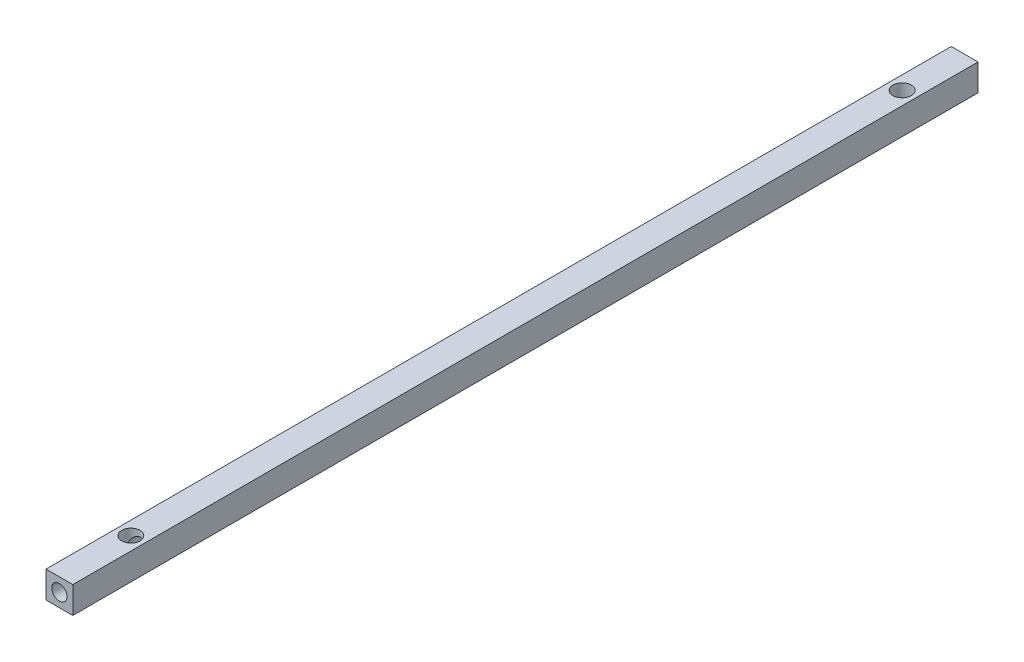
SolidWorks part; units mm, degrees
ref_plane "Front Plane" through (0, 0, 0) normal (0, 0, 1) x (1, 0, 0)
ref_plane "Top Plane" through (0, 0, 0) normal (0, 1, 0) x (1, 0, 0)
ref_plane "Right Plane" through (0, 0, 0) normal (1, 0, 0) x (0, 0, -1)
sketch "Sketch1" plane through (0, 0, 0) normal (0, 0, 1) x (1, 0, 0)
  line L1 (0, 0) -> (4.7625, 0)
  line L2 (0, 0) -> (0, 4.7625)
  line L3 (0, 4.7625) -> (4.7625, 4.7625)
  line L4 (4.7625, 0) -> (4.7625, 4.7625)
  dimension "D1" = 4.7625
  dimension "D2" = 4.7625
extrude "Extrude1" add sketch "Sketch1" along normal blind 160.9725
hole_wizard "#6-32 Tapped Hole1" positions "Sketch3" profile "Sketch2" tap size "#6-32" standard "Ansi Inch"
sketch "Sketch3" plane through (0, 0, 160.9725) normal (0, 0, 1) x (1, 0, 0)
  line L0 (4.7625, 2.3812) -> (2.3813, 2.3812) construction
  line L1 (4.7625, 0) -> (4.7625, 4.7625) construction
  line L2 (2.3813, 2.3812) -> (0, 2.3812) construction
  line L3 (0, 4.7625) -> (0, 0) construction
  point P0 (2.3813, 2.3812)
sketch "Sketch2" plane through (2.3813, 2.3812, 160.9725) normal (1, 0, 0) x (0, -1, 0)
  line L0 (0, 0) -> (0, 17.5767)
  line L1 (0, 17.5767) -> (1.3525, 16.764)
  line L2 (1.3525, 16.764) -> (1.3525, 0)
  line L5 (1.3525, 0) -> (0, 0)
  line L10 (0, 17.5767) -> (-1.3526, 16.764) construction
  line L11 (0, -6.35) -> (0, 107.95) construction
  dimension "Tap Drill Dia." = 2.7051
  dimension "Tap Drill Depth" = 16.764
  dimension "Drill Angle" = 118
hole_wizard "#4 Clearance Hole1" positions "Sketch5" profile "Sketch6" hole size "#4" standard "Ansi Inch"
sketch "Sketch5" plane through (0, 4.7625, 0) normal (0, 1, 0) x (-1, 0, 0)
  line L0 (-2.3812, 11.1125) -> (-2.3812, 0) construction
  line L1 (-4.7625, 0) -> (0, 0) construction
  line L4 (-2.3813, 148.2725) -> (-2.3813, 160.9725) construction
  line L5 (-4.7625, 160.9725) -> (0, 160.9725) construction
  point P0 (-2.3813, 148.2725)
  point P1 (-2.3812, 11.1125)
  dimension "D1" = 137.16
  dimension "D2" = 12.7
sketch "Sketch6" plane through (2.3813, 4.7625, 148.2725) normal (1, 0, 0) x (0, 0, 1)
  line L0 (0, 0) -> (0, 11.9026)
  line L1 (0, 11.9026) -> (1.6319, 10.922)
  line L2 (1.6319, 10.922) -> (1.6319, 0)
  line L5 (1.6319, 0) -> (0, 0)
  line L10 (0, 11.9026) -> (-1.632, 10.922) construction
  line L11 (0, -6.35) -> (0, 107.95) construction
  dimension "Hole Dia." = 3.2639
  dimension "Hole Depth" = 10.922
  dimension "Drill Angle" = 118
